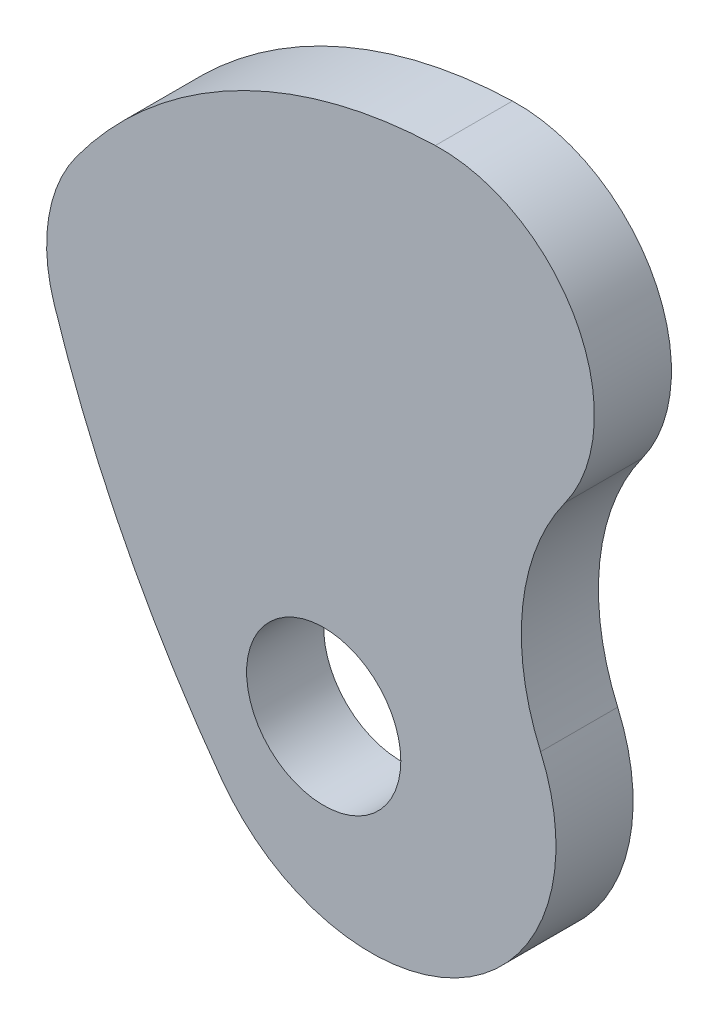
SolidWorks part; units mm, degrees
ref_plane "Front Plane" through (0, 0, 0) normal (0, 0, 1) x (1, 0, 0)
ref_plane "Top Plane" through (0, 0, 0) normal (0, 1, 0) x (1, 0, 0)
ref_plane "Right Plane" through (0, 0, 0) normal (1, 0, 0) x (0, 0, -1)
sketch "Sketch1" plane through (0, 0, 0) normal (0, 0, 1) x (1, 0, 0)
  circle A0 centre (0, 0) radius 5
  arc A1 (-17.4824, 14.4378) -> (-6.6167, -6.8299) centre (53.8867, 37.491) ccw
  arc A2 (-16.0363, 23.4174) -> (7.24, 35.6854) centre (8.173, 5.6999) cw
  arc A3 (-6.6167, -6.8299) -> (14.0644, 5.056) centre (3.0639, 0.2614) ccw
  arc A4 (-16.0363, 23.4174) -> (-17.4824, 14.4378) centre (-7.9666, 17.5116) ccw
  arc A5 (15.6567, 19.8338) -> (7.24, 35.6854) centre (7.551, 25.6903) ccw
  arc A6 (14.0644, 5.056) -> (15.6567, 19.8338) centre (27.8152, 11.0491) cw
  point P13 (-15.8201, 31.9957)
  point P16 (15.8201, 31.9957)
  dimension "D1" = 10
  dimension "D4" = 30
  dimension "D6" = 10
  dimension "D2" = 75
  dimension "D3" = 12
  dimension "D5" = 15
  dimension "D7" = 3.0639
  dimension "D8" = 7.24
  dimension "D9" = 7.551
  dimension "D10" = 14.0644
  dimension "D11" = 53.8867
  dimension "D12" = 0.2614
  dimension "D13" = 15.8201
  dimension "D18" = 15.8201
  dimension "D23" = 31.9957
extrude "Extrude2" add sketch "Sketch1" along normal blind 5
